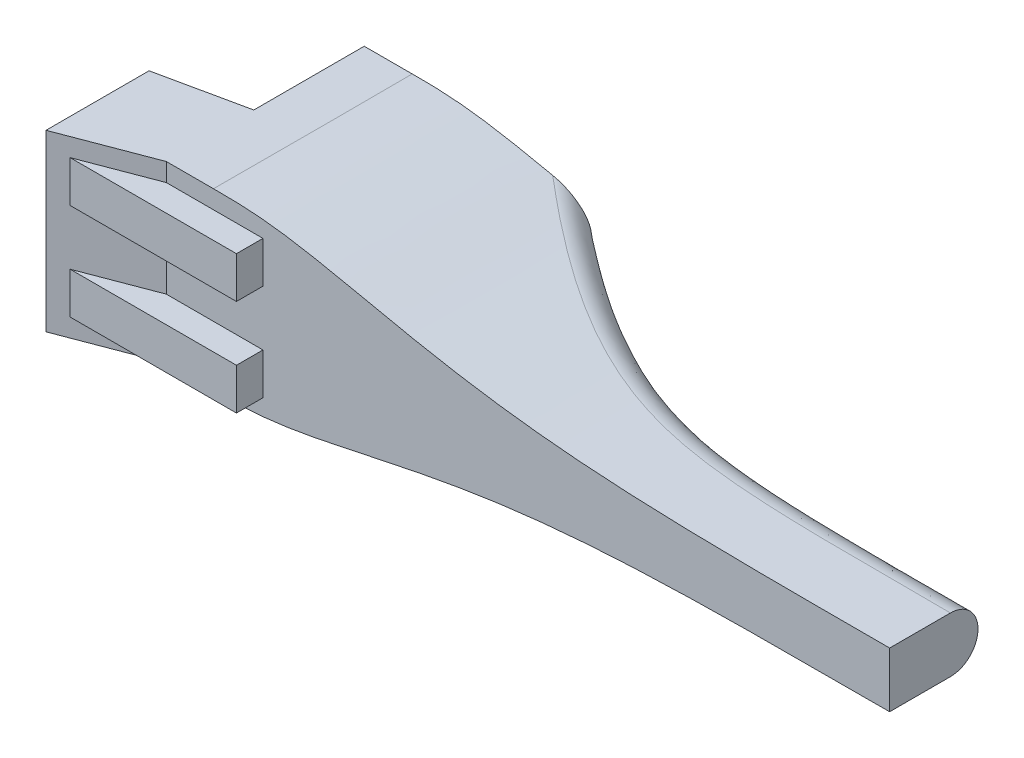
SolidWorks part; units mm, degrees
ref_plane "Piano frontale" through (0, 0, 0) normal (0, 0, 1) x (1, 0, 0)
ref_plane "Piano superiore" through (0, 0, 0) normal (0, 1, 0) x (1, 0, 0)
ref_plane "Piano destro" through (0, 0, 0) normal (1, 0, 0) x (0, 0, -1)
imported_body "Importato1"
mirror "Specchia1"
